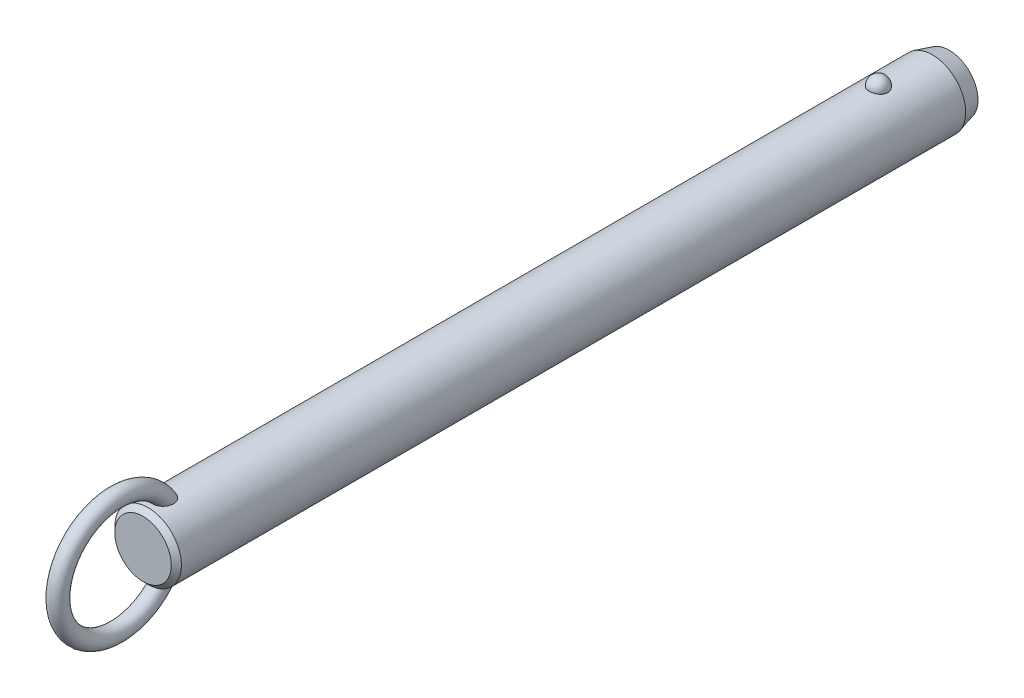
SolidWorks part; units mm, degrees
ref_plane "Front Plane" through (0, 0, 0) normal (0, 0, 1) x (1, 0, 0)
ref_plane "Top Plane" through (0, 0, 0) normal (0, 1, 0) x (1, 0, 0)
ref_plane "Right Plane" through (0, 0, 0) normal (1, 0, 0) x (0, 0, -1)
sketch "Sketch2" plane through (0, 0, 0) normal (0, 0, 1) x (1, 0, 0)
  circle A0 centre (0, 0) radius 7.9
  point P3 (0, 7.9)
  dimension "D1" = 15.8
extrude "Boss-Extrude1" add sketch "Sketch2" along normal blind 162.6
sketch "Sketch3" plane through (0, 0, 0) normal (0, 0, -1) x (-1, 0, 0)
  circle A0 centre (0, 0) radius 7.9
  dimension "D1" = 15.8
extrude "Boss-Extrude2" add sketch "Sketch3" along normal blind 19
chamfer "Chamfer1" distance 4 angle 15 1 edges at (-7.9, 0, -19)
sketch "Sketch12" plane through (0, 0, 0) normal (1, 0, 0) x (0, 0, -1)
  line L0 (-162.6, 7.9) -> (-162.6, -7.9) construction
  point P0 (-162.6, 0)
sketch "Sketch13" plane through (0, 0, 0) normal (1, 0, 0) x (0, 0, -1)
  circle A0 centre (-178.45, 0) radius 15.85
  point P2 (-162.6, 0)
  dimension "D1" = 31.7
sketch "Sketch14" plane through (0, 0, 0) normal (0, 1, 0) x (1, 0, 0)
  circle A0 centre (0, -164.6) radius 2
  point P2 (0, -162.6)
  dimension "D1" = 4
sweep "Sweep1" add profiles "Sketch14" path "Sketch13"
sketch "Sketch15" plane through (0, 0, 162.6) normal (0, 0, 1) x (1, 0, 0)
  circle A0 centre (0, 0) radius 7.9
  dimension "D1" = 15.8
extrude "Boss-Extrude3" add sketch "Sketch15" along normal blind 9.52
chamfer "Chamfer2" distance 1.2 angle 45 1 edges at (7.9, 0, 172.12)
sketch "Sketch18" plane through (0, 0, 0) normal (1, 0, 0) x (0, 0, -1)
  line L0 (15, 7.9) -> (-164.7091, 7.9) construction
  line L1 (2.2, 10.1) -> (2.2, 5.7)
  line L2 (-164.7091, -7.9) -> (15, -7.9) construction
  arc A0 (2.2, 10.1) -> (2.2, 5.7) centre (2.2, 7.9) ccw
  point P4 (0, 7.9)
  dimension "D1" = 18
revolve "Revolve1" add sketch "Sketch18" angle 360 about L1
